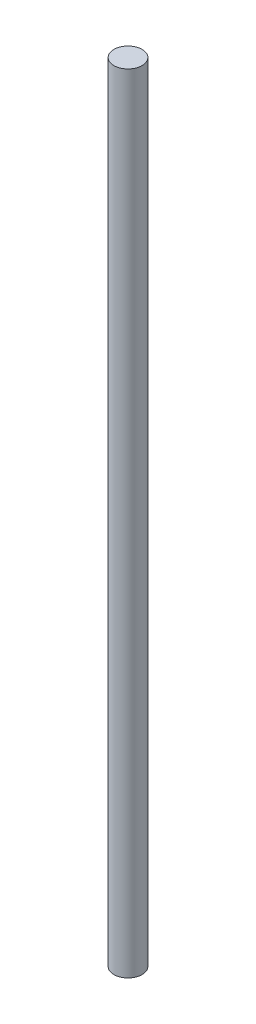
SolidWorks part; units mm, degrees
ref_plane "Front Plane" through (0, 0, 0) normal (0, 0, 1) x (1, 0, 0)
ref_plane "Top Plane" through (0, 0, 0) normal (0, 1, 0) x (1, 0, 0)
ref_plane "Right Plane" through (0, 0, 0) normal (1, 0, 0) x (0, 0, -1)
sketch "Sketch1" plane through (0, 0, 0) normal (0, 1, 0) x (1, 0, 0)
  circle A0 centre (0, 0) radius 6.35
  dimension "D1" = 12.7
extrude "Boss-Extrude1" add sketch "Sketch1" along normal blind 355.6
